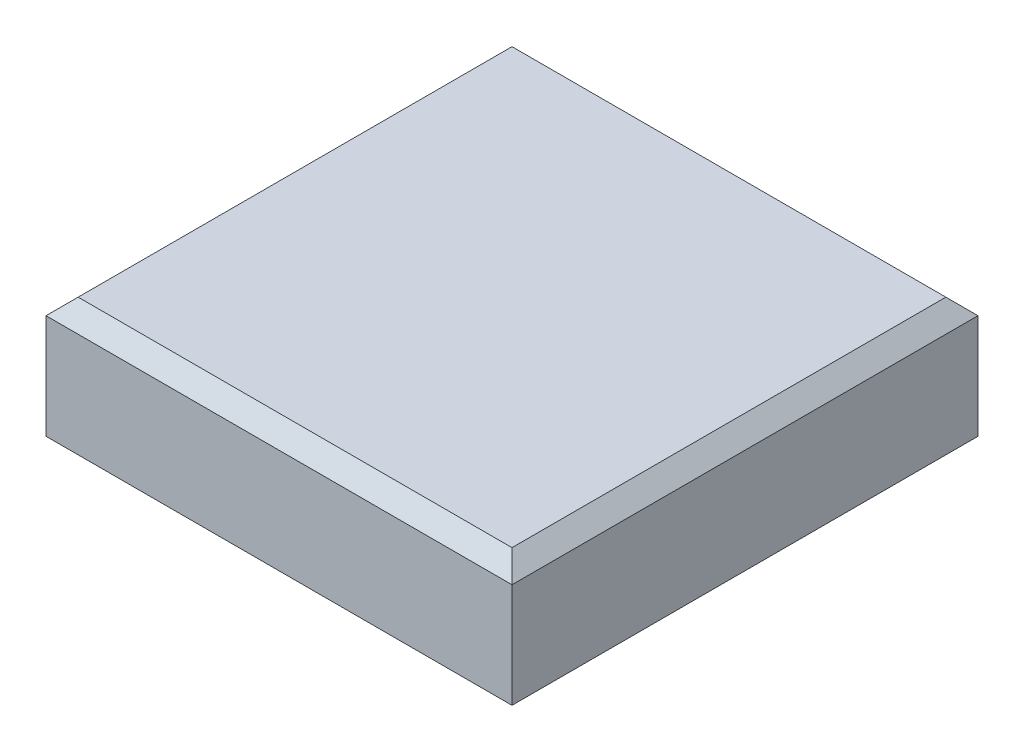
SolidWorks part; units mm, degrees
ref_plane "Front Plane" through (0, 0, 0) normal (0, 0, 1) x (1, 0, 0)
ref_plane "Top Plane" through (0, 0, 0) normal (0, 1, 0) x (1, 0, 0)
ref_plane "Right Plane" through (0, 0, 0) normal (1, 0, 0) x (0, 0, -1)
sketch "Sketch1" plane through (0, 0, 0) normal (0, 1, 0) x (1, 0, 0)
  line L1 (-145, 290) -> (145, 290)
  line L2 (-145, 290) -> (-145, 0)
  line L3 (-145, 0) -> (145, 0)
  line L4 (145, 290) -> (145, 0)
  dimension "D1" = 290
  dimension "D2" = 290
extrude "Boss-Extrude1" add sketch "Sketch1" along normal blind 75
chamfer "Chamfer1" distance 10 angle 45 4 edges at (0, 75, 0) (145, 75, -145) (0, 75, -290) (-145, 75, -145)
